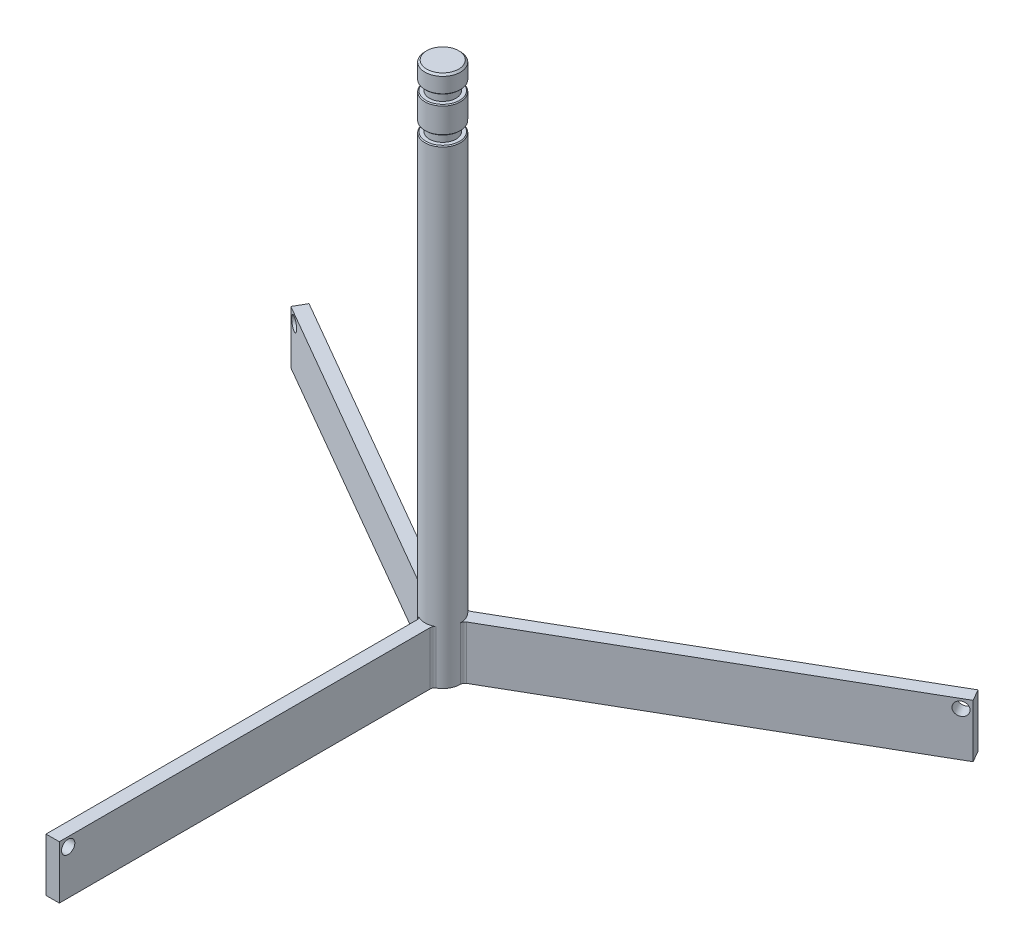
SolidWorks part; units mm, degrees
ref_plane "Plane1" through (0, 0, 0) normal (0, 0, 1) x (1, 0, 0)
ref_plane "Plane2" through (0, 0, 0) normal (0, 1, 0) x (1, 0, 0)
ref_plane "Plane3" through (0, 0, 0) normal (1, 0, 0) x (0, 0, -1)
sketch "Sketch1" plane through (0, 0, 0) normal (0, 1, 0) x (1, 0, 0)
  circle A0 centre (0, 0) radius 12.7
  dimension "D1" = 25.4
extrude "Center Shaft" add sketch "Sketch1" along normal blind 381
sketch "Sketch2" plane through (0, 0, 0) normal (0, 0, 1) x (1, 0, 0)
  line L0 (0, 0) -> (0, -56.9618) construction
  line L1 (4.7625, 0) -> (-4.7625, 0)
  line L2 (-12.7, 0) -> (12.7, 0) construction
  line L3 (-4.7625, 0) -> (-4.7625, 38.1)
  line L4 (4.7625, 0) -> (4.7625, 38.1)
  line L5 (-4.7625, 38.1) -> (4.7625, 38.1)
  point P7 (0, 0)
  point P11 (0, 38.1)
  dimension "D1" = 38.1
  dimension "D2" = 9.525
extrude "Arm" add sketch "Sketch2" along normal blind 279.4
sketch "Sketch3" plane through (-4.7625, 0, 0) normal (-1, 0, 0) x (0, 0, 1)
  line L0 (279.4, 0) -> (279.4, 38.1) construction
  line L1 (279.4, 38.1) -> (11.7732, 38.1) construction
  circle A0 centre (273.05, 31.75) radius 4.7625
  dimension "D1" = 9.525
  dimension "D2" = 6.35
  dimension "D3" = 6.35
extrude "Cut-Extrude1" cut sketch "Sketch3" against normal through all
fillet "Fillet1" radius 3.175 2 edges at (-4.7625, 19.05, 11.7732) (4.7625, 19.05, 11.7732)
pattern_circular "CirPattern1" count 3 every 120 about axis through (0, 0, 0) along (0, 1, 0) of "Arm", "Cut-Extrude1", "Fillet1"
sketch "Sketch4" plane through (0, 0, 0) normal (1, 0, 0) x (0, 0, -1)
  line L0 (-14.605, 336.55) -> (-14.605, 342.9)
  line L1 (-14.605, 342.9) -> (-9.525, 342.9)
  line L2 (-9.525, 342.9) -> (-9.525, 336.55)
  line L3 (-9.525, 336.55) -> (-14.605, 336.55)
  line L4 (0, 381) -> (0, 0) construction
  line L5 (12.7, 381) -> (-12.7, 381) construction
  line L6 (0, 0) -> (0, 32.7823) construction
  dimension "D1" = 5.08
  dimension "D2" = 6.35
  dimension "D3" = 9.525
  dimension "D4" = 38.1
revolve "Cut-Revolve1" cut sketch "Sketch4" angle 360 about L6
chamfer "Chamfer1" distance 0.635 angle 45 2 edges at (0, 342.9, 12.7) (0, 336.55, -12.7)
pattern_linear "LPattern1" count 2 spacing 25.4 along (0, 1, 0) of "Cut-Revolve1", "Chamfer1"
chamfer "Chamfer2" distance 1.27 angle 45 1 edges at (0, 381, 12.7)
